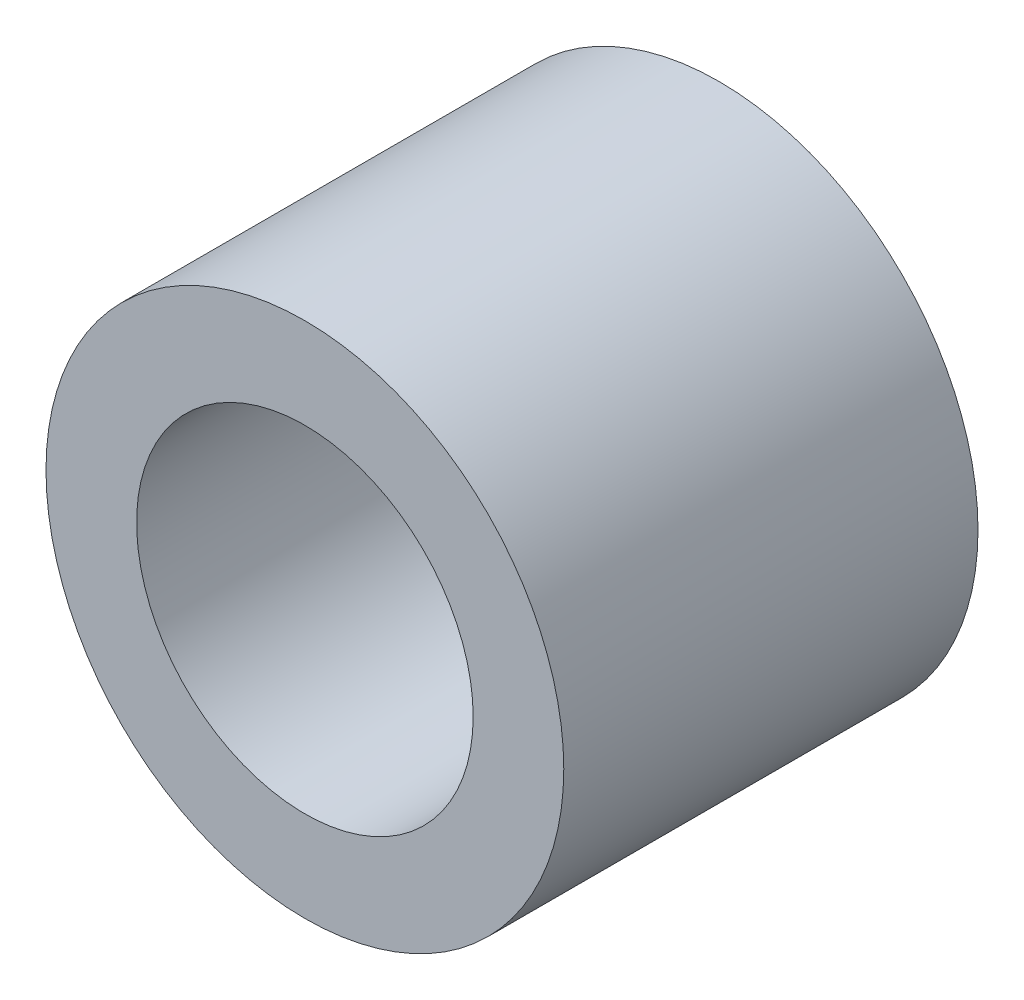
SolidWorks part; units mm, degrees
ref_plane "Face" through (0, 0, 0) normal (0, 0, 1) x (1, 0, 0)
ref_plane "Dessus" through (0, 0, 0) normal (0, 1, 0) x (1, 0, 0)
ref_plane "Droite" through (0, 0, 0) normal (1, 0, 0) x (0, 0, -1)
sketch "Esquisse1" plane through (0, 0, 0) normal (0, 0, 1) x (1, 0, 0)
  circle A0 centre (0, 0) radius 20
  circle A1 centre (0, 0) radius 13
  dimension "D1" = 40
  dimension "D2" = 26
extrude "Base-Extrusion" add sketch "Esquisse1" along normal blind 32
